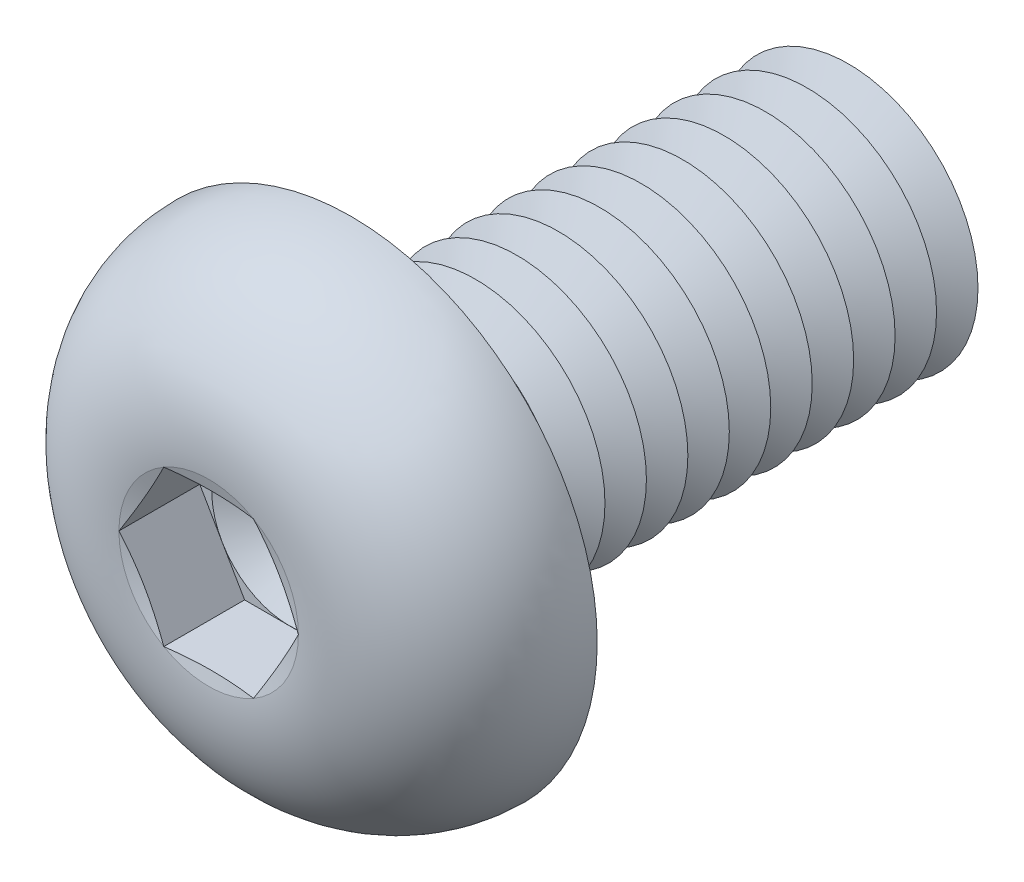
SolidWorks part; units mm, degrees
ref_plane "Front Plane" through (0, 0, 0) normal (0, 0, 1) x (1, 0, 0)
ref_plane "Top Plane" through (0, 0, 0) normal (0, 1, 0) x (1, 0, 0)
ref_plane "Right Plane" through (0, 0, 0) normal (1, 0, 0) x (0, 0, -1)
sketch "Sketch1" plane through (0, 0, 0) normal (1, 0, 0) x (0, 0, -1)
  line L0 (0, 2.5) -> (0, 4.75)
  line L3 (0, 2.5) -> (10, 2.5)
  line L4 (10, 2.5) -> (10, 0)
  line L5 (10, 0) -> (-2.75, 0) construction
  line L6 (-2.75, 0) -> (10, 0)
  line L7 (-2.75, 1.732) -> (-2.75, 0.866) construction
  line L8 (-2.75, 0.866) -> (-2.75, 0)
  line L9 (-2.75, 1.732) -> (-2.5179, 0.866)
  line L10 (-2.5179, 0.866) -> (-2.75, 0.866)
  line L11 (10, 0) -> (22.7481, 0) construction
  line L12 (0, 4.75) -> (-2.75, 4.75) construction
  arc A1 (0, 4.75) -> (-2.75, 1.732) centre (0, 1.9881) ccw
  point P8 (10, 1.25)
  dimension "D1" = 9.5
  dimension "D2" = 5
  dimension "D3" = 2.75
  dimension "D4" = 3.4641
  dimension "D5" = 10
  dimension "D6" = 15
revolve "Revolve1" add sketch "Sketch1" angle 360 about L5
fillet "Fillet1" radius 0.4 1 edges at (-2.5, 0, 0)
sketch "Sketch2" plane through (0, 0, 0) normal (1, 0, 0) x (0, 0, -1)
  line L0 (9.6, 2.5) -> (10.4, 2.5)
  line L1 (10, 2.5) -> (0.4, 2.5) construction
  line L2 (10.4, 2.5) -> (10, 1.8072)
  line L3 (10, -2.5) -> (10, 2.5) construction
  line L4 (10, 1.8072) -> (9.6, 2.5)
  dimension "D1" = 0.8
revolve "Cut-Revolve1" cut sketch "Sketch2" angle 360 about axis through (0, 0, -10) along (0, 0, -1)
pattern_linear "LPattern1" count 12 spacing 0.8 along (0, 0, 1) of "Cut-Revolve1"
sketch "Sketch3" plane through (0, 0, 2.75) normal (0, 0, 1) x (1, 0, 0)
  line L7 (0.866, 1.5) -> (-0.866, 1.5)
  line L8 (-0.866, 1.5) -> (-1.7321, 0)
  line L9 (-1.7321, 0) -> (-0.866, -1.5)
  line L10 (-0.866, -1.5) -> (0.866, -1.5)
  line L11 (0.866, -1.5) -> (1.7321, 0)
  line L12 (1.7321, 0) -> (0.866, 1.5)
  circle A0 centre (0, 0) radius 1.5 construction
  circle A3 centre (0, 0) radius 1.732 construction
extrude "Cut-Extrude1" cut sketch "Sketch3" against normal blind 1.56
sketch "Sketch4" plane through (0, 0, 1.19) normal (0, 0, 1) x (1, 0, 0)
  line L1 (0.866, 1.5) -> (-0.866, 1.5) construction
  circle A0 centre (0, 0) radius 1.5
extrude "Cut-Extrude2" cut sketch "Sketch4" against normal through all draft 60
